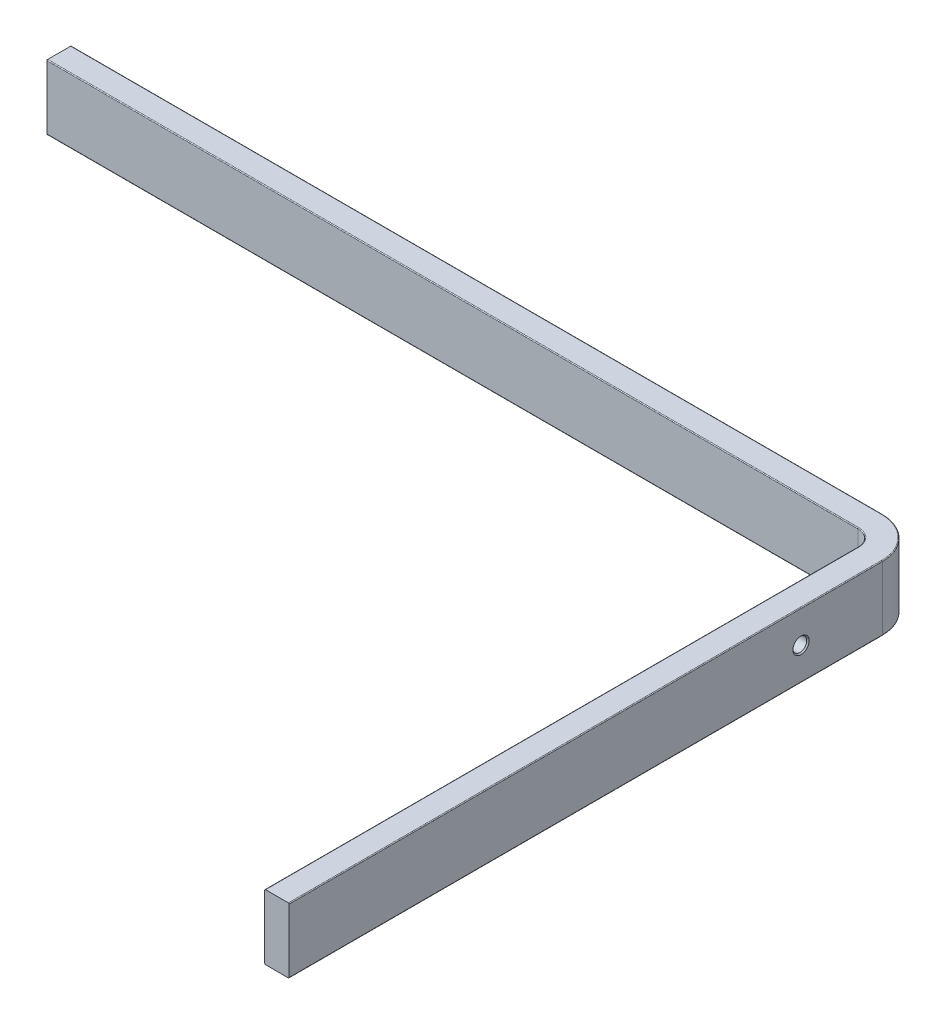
SolidWorks part; units mm, degrees
ref_plane "Plan de face" through (0, 0, 0) normal (0, 0, 1) x (1, 0, 0)
ref_plane "Plan de dessus" through (0, 0, 0) normal (0, 1, 0) x (1, 0, 0)
ref_plane "Plan de droite" through (0, 0, 0) normal (1, 0, 0) x (0, 0, -1)
ref_plane "Plan1" through (0, 20, 0) normal (0, 1, 0) x (1, 0, 0)
sketch "Esquisse1" plane through (0, 20, 0) normal (0, 1, 0) x (1, 0, 0)
  line L0 (0, 0) -> (-525, 0)
  line L1 (-525, 0) -> (-525, -390)
  line L2 (-525, -390) -> (0, -390)
  line L3 (0, -390) -> (0, 0)
extrude "Boss.-Extru.1" add sketch "Esquisse1" against normal blind 40
sketch "Esquisse2" plane through (0, -20, 0) normal (0, -1, 0) x (1, 0, 0)
  line L0 (-525, 15) -> (-15, 15)
  line L1 (-15, 15) -> (-15, 390)
  line L2 (-15, 390) -> (-525, 390)
  line L3 (-525, 390) -> (-525, 15)
extrude "Enlèv. mat.-Extru.1" cut sketch "Esquisse2" against normal through all
hole_wizard "Diamètre du perçage Ø8.5 (8.5)1" positions "Esquisse4" profile "Esquisse3" hole size "Ø8.5" standard "Ansi Metric"
sketch "Esquisse4" plane through (-15, 0, 0) normal (-1, 0, 0) x (0, 0, 1)
  point P0 (75, 0)
sketch "Esquisse3" plane through (-15, 0, 75) normal (0, 1, 0) x (0, 0, 1)
  line L0 (0, 0) -> (0, 15)
  line L1 (0, 15) -> (4.25, 15)
  line L2 (4.25, 15) -> (4.25, 0)
  line L5 (4.25, 0) -> (0, 0)
  line L11 (0, -6.35) -> (0, 107.95) construction
  dimension "Diamètre du perçage jusqu'au prochain" = 8.5
  dimension "Profondeur du perçage jusqu'au prochain" = 15
fillet "Congé1" radius 10 1 edges at (-15, 0, 15)
fillet "Congé2" radius 25 1 edges at (0, 0, 0)
chamfer "Chanfrein1" distance 1 angle 45 4 edges at (-525, 0, 0) (-525, 20, 7.5) (-525, 0, 15) (-525, -20, 7.5)
chamfer "Chanfrein2" distance 0.75 angle 45 2 edges at (0, 0, 79.25) (-15, 0, 79.25)
fillet "Congé3" radius 0.5 12 edges at (-274.5, -20, 0) (0, -20, 207.5) (-7.3223, -20, 7.3223) (-274.5, -20, 15) (-17.9289, -20, 17.9289) (-15, -20, 207.5) (-274.5, 20, 15) (-15, 20, 207.5) (-17.9289, 20, 17.9289) (-274.5, 20, 0) (-7.3223, 20, 7.3223) (0, 20, 207.5)
sketch "Esquisse6" plane through (0, 0, 0) normal (1, 0, 0) x (0, 0, -1)
  line L0 (-79.25, 0) -> (-70.75, 0)
  circle A0 centre (-75, 0) radius 4.25 construction
  point P0 (-75, 0)
